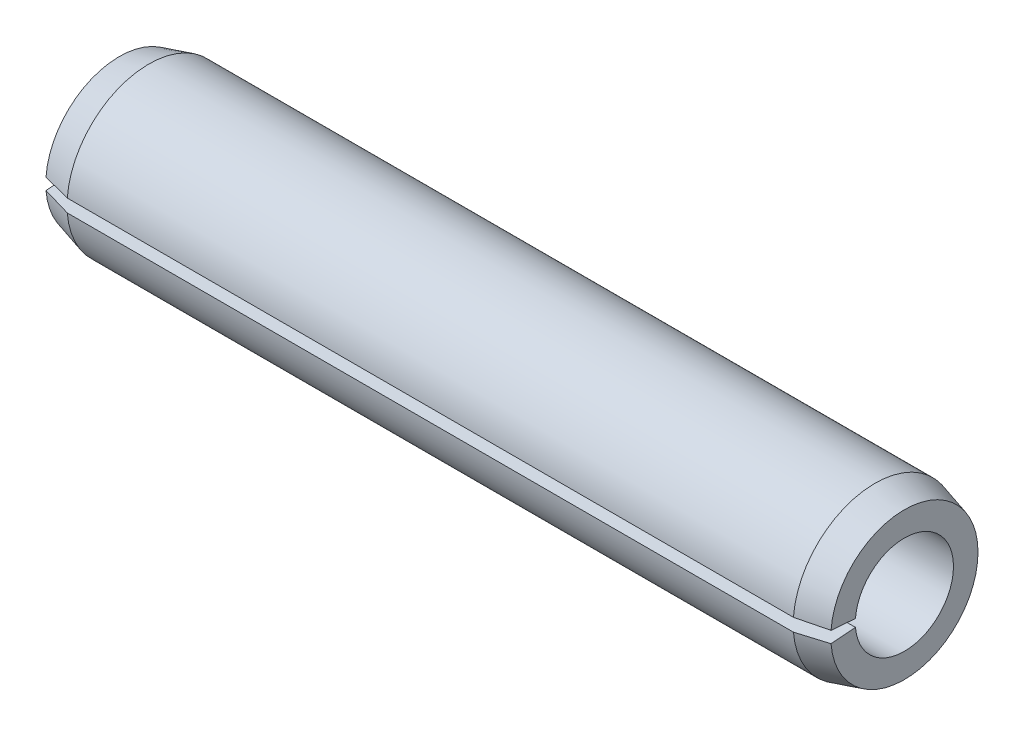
SolidWorks part; units mm, degrees
ref_plane "Plane1" through (0, 0, 0) normal (0, 0, 1) x (1, 0, 0)
ref_plane "Plane2" through (0, 0, 0) normal (0, 1, 0) x (1, 0, 0)
ref_plane "Plane3" through (0, 0, 0) normal (1, 0, 0) x (0, 0, -1)
sketch "Sketch1" plane through (0, 0, 0) normal (0, 0, 1) x (1, 0, 0)
  line L0 (-9.525, 0) -> (111.125, 0) construction
  line L1 (0, 1.5) -> (24, 1.5)
  line L2 (24, 1.5) -> (24, 2.25)
  line L3 (24, 2.25) -> (23.1, 2.5)
  line L4 (23.1, 2.5) -> (0.9, 2.5)
  line L5 (0.9, 2.5) -> (0, 2.25)
  line L7 (0, 2.25) -> (0, 1.5)
  dimension "D1" = 4.5
  dimension "D2" = 4.5
  dimension "Diameter" = 5
  dimension "D3" = 0.9
  dimension "Length" = 24
  dimension "Thickness" = 1
  dimension "Chamfer_len" = 0.9
revolve "Base-Revolve" add sketch "Sketch1" angle 360 about L0
sketch "Sketch2" plane through (0, 0, 0) normal (-1, 0, 0) x (0, -1, 0)
  line L0 (0, 0) -> (0.2001, 2.5421)
  line L1 (0, -3.175) -> (0, 12.7) construction
  line L2 (0, 0) -> (-0.2001, 2.5421)
  arc A0 (0.2001, 2.5421) -> (-0.2001, 2.5421) centre (0, 0) ccw
  dimension "D1" = 2.55
  dimension "Gap_ang" = 9
extrude "Gap" cut sketch "Sketch2" against normal through all
equation "\"D1@Sketch2\" = \"Diameter@Sketch1\" * 0.51"
equation "\"D1@Sketch1\" = \"Diameter@Sketch1\" -  ( \"Thickness@Sketch1\" / 2 ) "
equation "\"D2@Sketch1\" = \"D1@Sketch1\""
equation "\"D3@Sketch1\" = \"Chamfer_len@Sketch1\""
